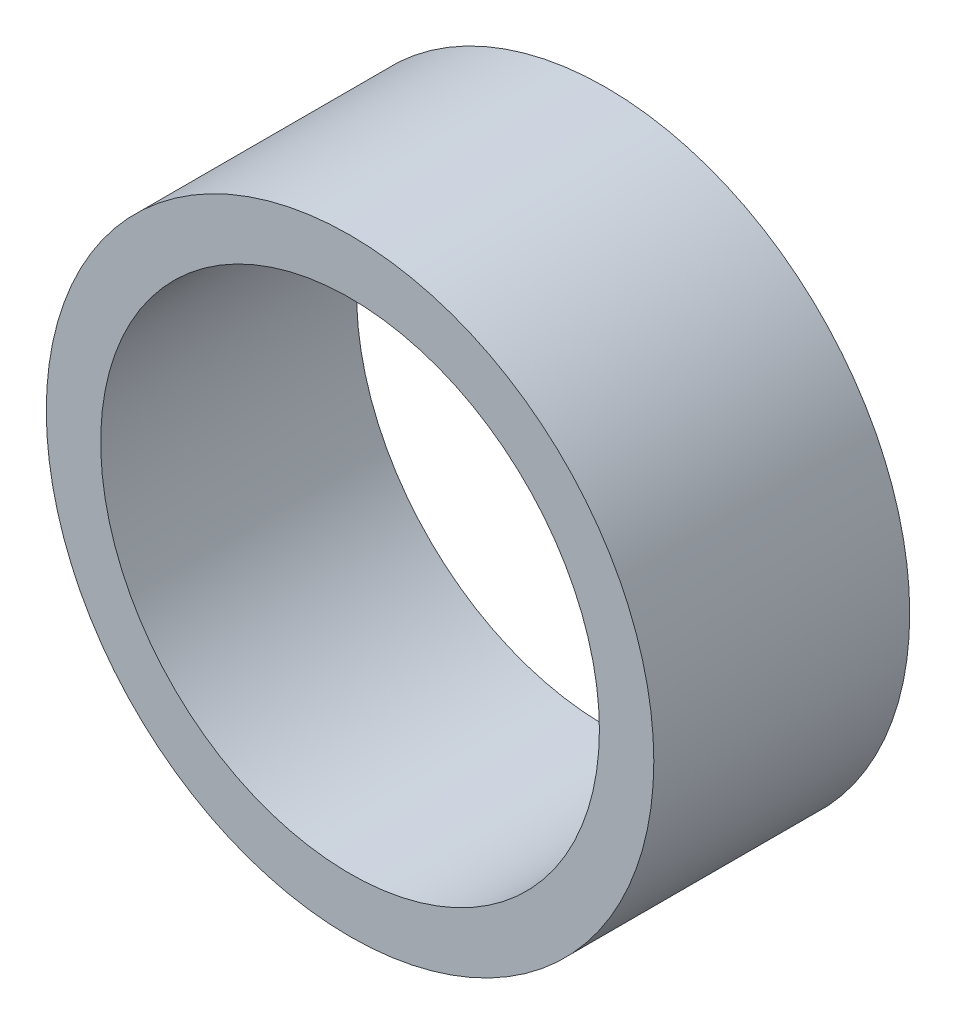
SolidWorks part; units mm, degrees
ref_plane "Front Plane" through (0, 0, 0) normal (0, 0, 1) x (1, 0, 0)
ref_plane "Top Plane" through (0, 0, 0) normal (0, 1, 0) x (1, 0, 0)
ref_plane "Right Plane" through (0, 0, 0) normal (1, 0, 0) x (0, 0, -1)
other "Configuration Table"
sketch "Sketch1" plane through (0, 0, 0) normal (0, 0, 1) x (1, 0, 0)
  circle A0 centre (0, 0) radius 24.75
  circle A1 centre (0, 0) radius 30.15
  dimension "Out_dia" = 60.3
  dimension "Thickness" = 5.4
extrude "BaseSection" add sketch "Sketch1" along normal mid plane 25.4
